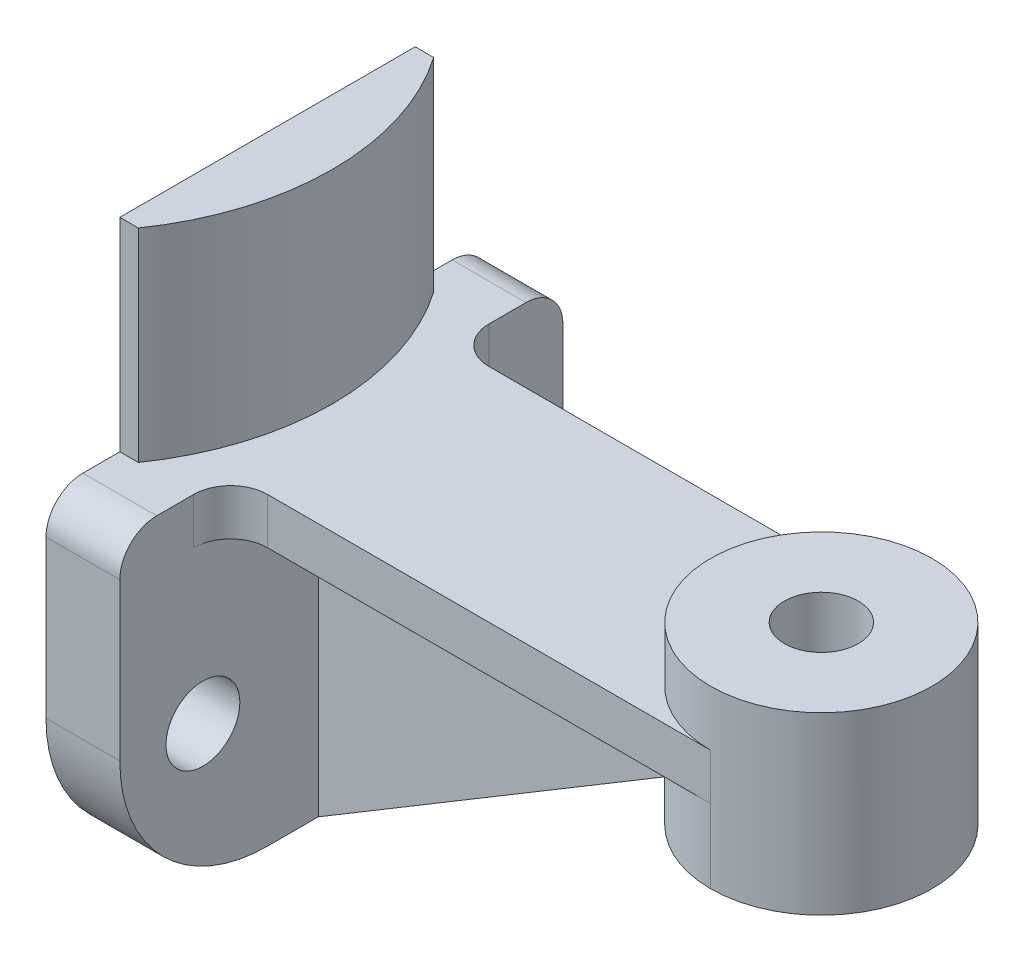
SolidWorks part; units mm, degrees
other "DetailItem1"
other "DetailItem2"
other "DetailItem3"
ref_plane "Front" through (0, 0, 0) normal (0, 0, 1) x (1, 0, 0)
ref_plane "Top" through (0, 0, 0) normal (0, 1, 0) x (1, 0, 0)
ref_plane "Right" through (0, 0, 0) normal (1, 0, 0) x (0, 0, -1)
sketch "Sketch1" plane through (0, 0, 0) normal (1, 0, 0) x (0, 0, -1)
  line L0 (0, 0) -> (76.2, 0)
  line L1 (0, 0) -> (0, 58.7375)
  line L2 (76.2, 58.7375) -> (0, 58.7375)
  line L3 (76.2, 58.7375) -> (76.2, 0)
  dimension "D1" = 76.2
  dimension "D2" = 58.7375
extrude "Base-Extrude" add sketch "Sketch1" along normal blind 12.7
sketch "Sketch2" plane through (12.7, 0, 0) normal (1, 0, 0) x (0, 0, -1)
  line L0 (19.05, 58.7375) -> (57.15, 58.7375)
  line L1 (19.05, 58.7375) -> (19.05, 50.8)
  line L2 (57.15, 50.8) -> (19.05, 50.8)
  line L3 (57.15, 50.8) -> (57.15, 58.7375)
  line L4 (76.2, 58.7375) -> (0, 58.7375) construction
  line L5 (38.1, 58.7375) -> (38.1, 0) construction
  line L6 (0, 0) -> (76.2, 0) construction
  dimension "D1" = 7.9375
  dimension "D2" = 38.1
extrude "Boss-Extrude3" add sketch "Sketch2" along normal offset from surface (82.55 mm away) 95.25
ref_plane "Plane4" through (0, 68.2625, 0) normal (0, 1, 0) x (-1, 0, 0)
sketch "Sketch4" plane through (0, 68.2625, 0) normal (0, 1, 0) x (-1, 0, 0)
  line L0 (-95.25, -57.15) -> (-95.25, -19.05) construction
  circle A0 centre (-95.25, -38.1) radius 19.05
extrude "Boss-Extrude4" add sketch "Sketch4" against normal blind 30.1625
sketch "Sketch5" plane through (0, 58.7375, 0) normal (0, 1, 0) x (-1, 0, 0)
  line L0 (0, -63.5) -> (-3.175, -63.5)
  line L1 (0, -63.5) -> (0, -12.7)
  line L2 (-3.175, -12.7) -> (0, -12.7)
  line L4 (0, -76.2) -> (0, 0) construction
  arc A0 (-3.175, -12.7) -> (-3.175, -63.5) centre (33.303, -38.1) ccw
  point P6 (0, -38.1)
  dimension "D3" = 44.45
  dimension "D1" = 50.8
  dimension "D2" = 3.175
extrude "Boss-Extrude5" add sketch "Sketch5" along normal blind 34.925
sketch "Sketch6" plane through (0, 0, 0) normal (1, 0, 0) x (0, 0, -1)
  line L0 (63.5, 93.6625) -> (12.7, 93.6625) construction
  line L1 (0, 0) -> (76.2, 0) construction
  point P0 (38.1, 93.6625)
  point P1 (38.1, 0)
sketch "Sketch7" plane through (0, 0, 0) normal (0, 1, 0) x (1, 0, 0)
  line L0 (12.7, 0) -> (12.7, 76.2) construction
  point P0 (12.7, 38.1)
ref_plane "Plane5" through (0, 0, -38.1) normal (0, 0, -1) x (-1, 0, 0)
sketch "Sketch8" plane through (0, 0, -38.1) normal (0, 0, -1) x (-1, 0, 0)
  line L0 (-12.7, 0) -> (-95.25, 49.53)
  line L2 (-12.7, 50.8) -> (-12.7, 0)
  line L3 (-95.25, 50.8) -> (-12.7, 50.8) construction
  line L4 (-95.25, 50.8) -> (-12.7, 50.8)
  line L5 (-95.25, 50.8) -> (-95.25, 49.53)
  line L6 (-95.25, 50.8) -> (-95.25, 58.7375) construction
  point P0 (-76.2, 38.1)
extrude "Boss-Extrude7" add sketch "Sketch8" along normal mid plane 7.9375
sketch "Sketch9" plane through (12.7, 0, 0) normal (1, 0, 0) x (0, 0, -1)
  line L0 (19.05, 58.7375) -> (0, 58.7375) construction
  line L1 (14.2875, 23.8125) -> (61.9125, 23.8125) construction
  line L2 (38.1, 23.8125) -> (38.1, 0) construction
  line L3 (42.0688, 0) -> (34.1313, 0) construction
  circle A0 centre (14.2875, 23.8125) radius 6.35
  circle A1 centre (61.9125, 23.8125) radius 6.35
  dimension "D1" = 12.7
  dimension "D2" = 34.925
  dimension "D3" = 47.625
extrude "Cut-Extrude1" cut sketch "Sketch9" against normal through all
sketch "Sketch10" plane through (0, 68.2625, 0) normal (0, 1, 0) x (-1, 0, 0)
  circle A0 centre (-95.25, -38.1) radius 6.35
  circle A1 centre (-95.25, -38.1) radius 19.05 construction
  dimension "D1" = 12.7
extrude "Cut-Extrude2" cut sketch "Sketch10" against normal through all
sketch "Sketch11" plane through (0, 0, -38.1) normal (0, 0, -1) x (-1, 0, 0)
  line L0 (-101.6, 38.1) -> (-88.9, 38.1) construction
  circle A0 centre (-95.25, 44.45) radius 2.1828
  dimension "D1" = 4.3656
  dimension "D2" = 6.35
extrude "Cut-Extrude3" cut sketch "Sketch11" against normal through all and the other way through all
fillet "Fillet1" radius 6.35 6 edges at (6.35, 58.7375, -76.2) (6.35, 58.7375, 0)
fillet "Fillet2" radius 25.4 2 edges at (6.35, 0, 0) (6.35, 0, -76.2)
fillet "Fillet4" radius 1.524
fillet "Fillet5" radius 1.524
fillet "Fillet6" radius 1.524
fillet "Fillet7" radius 1.524
fillet "Fillet10" radius 1.524
fillet "Fillet11" radius 1.524
